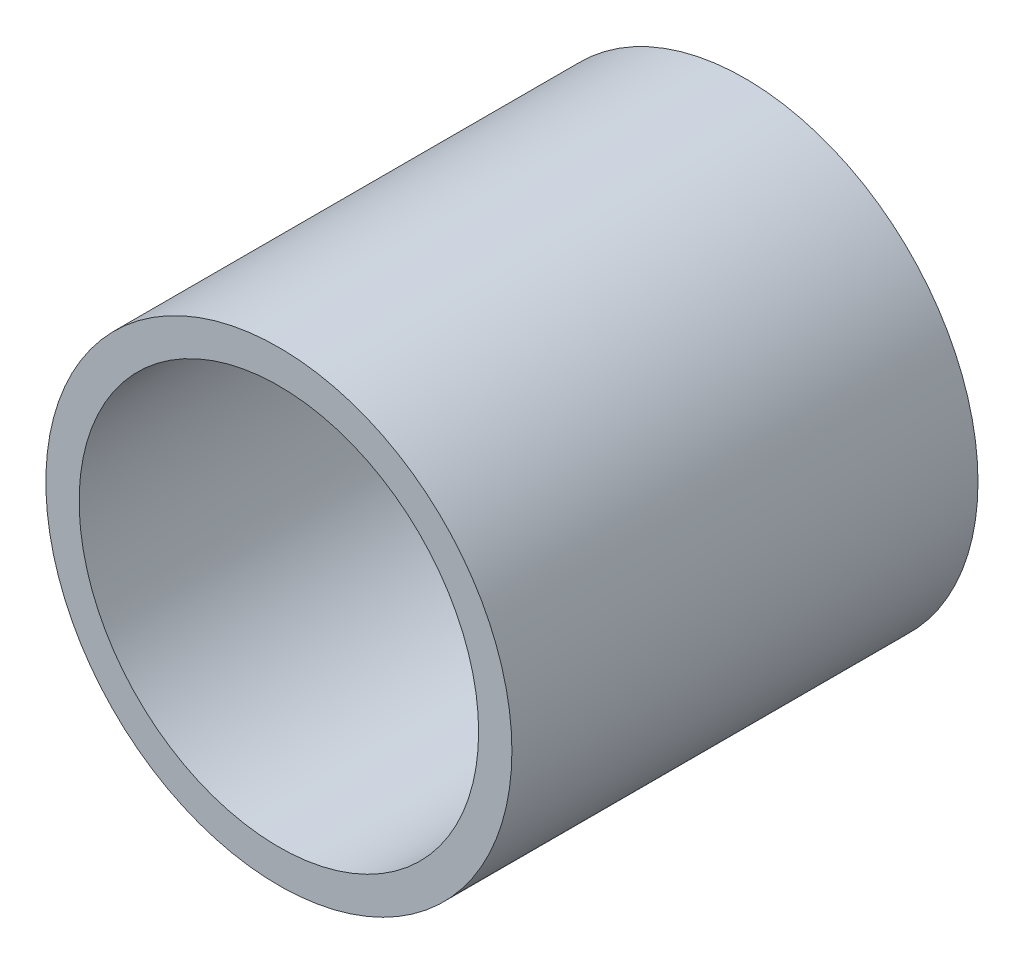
SolidWorks part; units mm, degrees
ref_plane "Plan de face" through (0, 0, 0) normal (0, 0, 1) x (1, 0, 0)
ref_plane "Plan de dessus" through (0, 0, 0) normal (0, 1, 0) x (1, 0, 0)
ref_plane "Plan de droite" through (0, 0, 0) normal (1, 0, 0) x (0, 0, -1)
sketch "Esquisse1" plane through (0, 0, 0) normal (0, 0, 1) x (1, 0, 0)
  circle A0 centre (0, 0) radius 12
  circle A1 centre (0, 0) radius 14
  dimension "D1" = 24
  dimension "D2" = 28
extrude "Boss.-Extru.1" add sketch "Esquisse1" along normal blind 28
